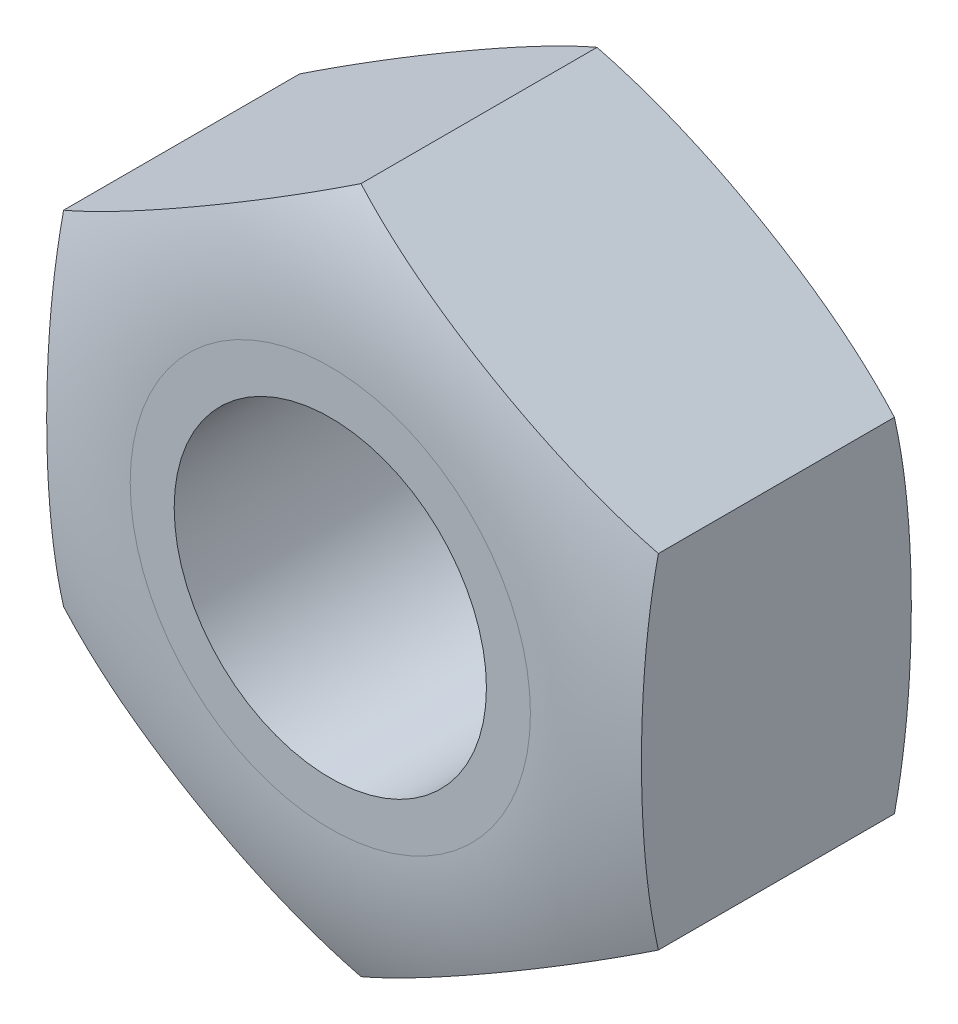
SolidWorks part; units mm, degrees
ref_plane "Ebene vorne" through (0, 0, 0) normal (0, 0, 1) x (1, 0, 0)
ref_plane "Ebene oben" through (0, 0, 0) normal (0, 1, 0) x (1, 0, 0)
ref_plane "Ebene rechts" through (0, 0, 0) normal (1, 0, 0) x (0, 0, -1)
sketch "Skizze1" plane through (0, 0, 0) normal (0, 0, 1) x (1, 0, 0)
  line L1 (4, 2.3094) -> (0, 4.6188)
  line L2 (0, 4.6188) -> (-4, 2.3094)
  line L3 (-4, 2.3094) -> (-4, -2.3094)
  line L4 (-4, -2.3094) -> (0, -4.6188)
  line L5 (0, -4.6188) -> (4, -2.3094)
  line L6 (4, -2.3094) -> (4, 2.3094)
  circle A0 centre (0, 0) radius 4 construction
  dimension "D1" = 8
extrude "Aufsatz-Linear austragen1" add sketch "Skizze1" along normal blind 4
hole_wizard "M5 Gewindebohrung1" positions "Skizze2" profile "Skizze3" tap size "M5" standard "DIN"
sketch "Skizze2" plane through (0, 0, 4) normal (0, 0, 1) x (1, 0, 0)
  point P0 (0, 0)
sketch "Skizze3" plane through (0, 0, 4) normal (1, 0, 0) x (0, -1, 0)
  line L0 (0, 0) -> (0, 4)
  line L1 (0, 4) -> (2.1, 4)
  line L2 (2.1, 4) -> (2.1, 0)
  line L5 (2.1, 0) -> (0, 0)
  line L11 (0, -6.35) -> (0, 107.95) construction
  dimension "Bohrerdurchmesser" = 4.2
  dimension "Bohrungstiefe" = 4
sketch "Skizze4" plane through (0, 0, 0) normal (0, 1, 0) x (1, 0, 0)
  line L0 (-4.7, -3.55) -> (-4.7, -4)
  line L1 (-4.7, -4) -> (-2.6915, -4)
  line L2 (-4, -4) -> (0, -4) construction
  line L3 (0, -4) -> (-4, -4) construction
  line L4 (-8.7093, -2) -> (-0.9115, -2) construction
  line L5 (0, 0) -> (-4, 0) construction
  line L6 (-4.7, 0) -> (-2.6915, 0)
  line L7 (-4.7, -0.45) -> (-4.7, 0)
  line L8 (0, -4) -> (0, 0) construction
  line L9 (0, -0.7159) -> (0, -6.0251) construction
  arc A0 (-4.7, -3.55) -> (-2.6915, -4) centre (-2.6915, 0.7071) ccw
  arc A1 (-4.7, -0.45) -> (-2.6915, 0) centre (-2.6915, -4.7071) cw
  dimension "D1" = 0.45
  dimension "D2" = 4.7
revolve "Schnitt-Rotation1" cut sketch "Skizze4" angle 360 about L9
